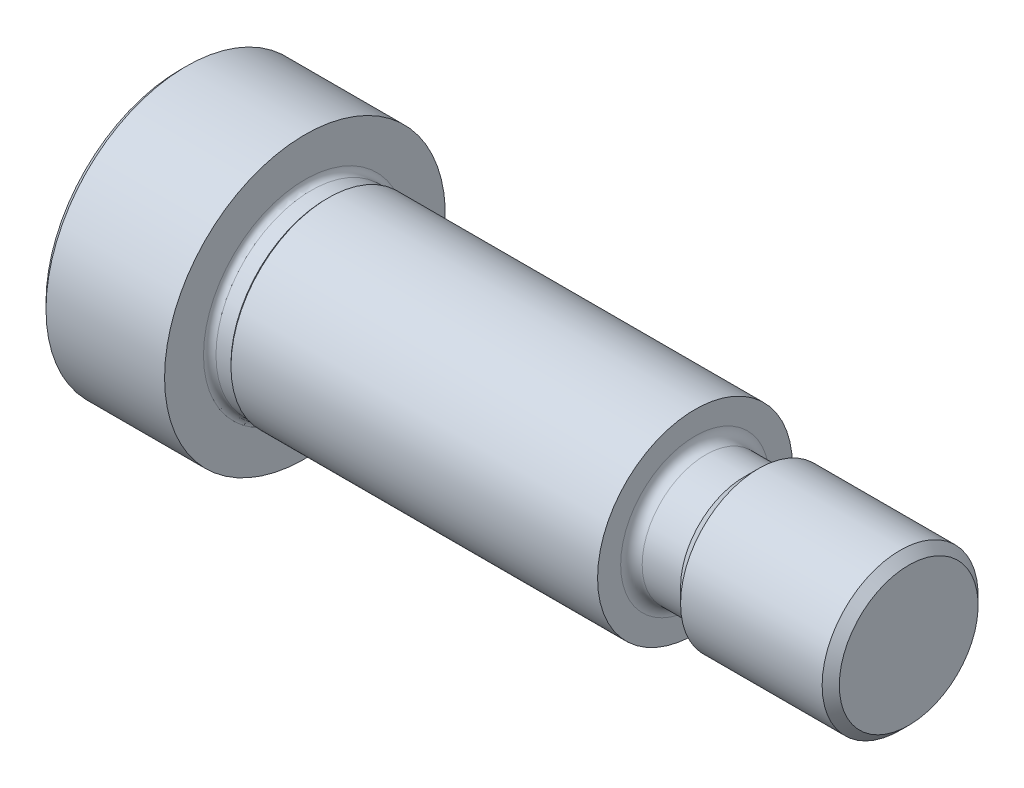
SolidWorks part; units mm, degrees
ref_plane "Plane1" through (0, 0, 0) normal (0, 0, 1) x (1, 0, 0)
ref_plane "Plane2" through (0, 0, 0) normal (0, 1, 0) x (1, 0, 0)
ref_plane "Plane3" through (0, 0, 0) normal (1, 0, 0) x (0, 0, -1)
sketch "BodySke" plane through (0, 0, 0) normal (0, 0, 1) x (1, 0, 0)
  line L0 (0, 0) -> (0, 18)
  line L2 (0, 18) -> (16, 18)
  line L3 (16, 18) -> (16, 13.01)
  line L4 (16.8, 12.21) -> (18.72, 12.21)
  line L5 (18.72, 12.21) -> (19, 12.49)
  line L6 (19, 12.49) -> (66, 12.49)
  line L7 (66, 12.49) -> (66, 9.53)
  line L8 (67.38, 8.15) -> (72.3, 8.15)
  line L9 (72.3, 8.15) -> (74.15, 10)
  line L10 (74.15, 10) -> (92.2985, 10)
  line L11 (92.2985, 10) -> (93.4, 8.8985)
  line L12 (93.4, 8.8985) -> (93.4, 0)
  line L13 (93.4, 0) -> (0, 0)
  line L14 (-6.35, 0) -> (107.95, 0) construction
  line L15 (92.2985, -10) -> (93.4, -8.8985) construction
  line L16 (66, -8.15) -> (72.3, -8.15) construction
  line L17 (19, -12.49) -> (66, -12.49) construction
  line L18 (16, -12.21) -> (18.72, -12.21) construction
  line L20 (74.8, 13.0014) -> (74.8, -4.3514) construction
  line L21 (70.54, 12.6746) -> (70.54, -3.175) construction
  arc A0 (66, 9.53) -> (67.38, 8.15) centre (67.38, 9.53) ccw
  arc A1 (16.8, 12.21) -> (16, 13.01) centre (16.8, 13.01) cw
  point P29 (66, 8.15)
  point P32 (16, 12.21)
  dimension "Thread_neck_fillet_rad" = 1.38
  dimension "Head_fillet_radius" = 0.8
  dimension "Head_dia" = 36
  dimension "Head_ht" = 16
  dimension "Shoulder_neck_dia" = 24.42
  dimension "Diameter" = 24.98
  dimension "Thread_dia" = 20
  dimension "Minor_dia" = 17.797
  dimension "Thread_ch_ang" = 45
  dimension "Thread_neck_dia" = 16.3
  dimension "D11" = 45
  dimension "Thread_length" = 27.4
  dimension "D13" = 45
  dimension "Length" = 50
  dimension "Thread_neck_width" = 6.3
  dimension "Shoulder_neck_width" = 3
  dimension "Advance" = 2.5
  dimension "Thread_nom" = 22.86
  dimension "Thread_lim" = 18.6
revolve "BaseBody" add sketch "BodySke" angle 360 about L14
chamfer "Chamfer1" distance 0.8 1 edges at (0, 0, 18)
sketch "Sketch2" plane through (0, 0, 0) normal (0, 0, 1) x (1, 0, 0)
  line L0 (0, 6) -> (10, 6)
  line L1 (10, 6) -> (13.4641, 0)
  line L3 (13.4641, 0) -> (0, 0)
  line L4 (0, 0) -> (0, 6)
  line L5 (0, -6) -> (10, -6) construction
  line L6 (0, 0) -> (47.625, 0) construction
  dimension "D2" = 60
  dimension "PreBroach_depth" = 10
  dimension "PreBroach_dia" = 12
revolve "PreBroach" cut sketch "Sketch2" angle 360 about L6
sketch "Sketch3" plane through (0, 0, 0) normal (-1, 0, 0) x (0, 0, 1)
  line L0 (-6, -3.4641) -> (-6, 3.4641)
  line L1 (-6, 3.4641) -> (0, 6.9282)
  line L2 (0, 6.9282) -> (6, 3.4641)
  line L3 (6, 3.4641) -> (6, -3.4641)
  line L4 (6, -3.4641) -> (0, -6.9282)
  line L5 (0, -6.9282) -> (-6, -3.4641)
  dimension "D1" = 6
  dimension "Hex_size" = 12
  dimension "D2" = 6
  dimension "D3" = 120
  dimension "D4" = 12
extrude "Hex" cut sketch "Sketch3" against normal blind 10
sketch "ThdSchSke" plane through (0, 0, 0) normal (0, 0, 1) x (1, 0, 0)
  line L0 (74.8, -8.8985) -> (72.2852, -12.49)
  line L1 (74.8, -8.8985) -> (77.3148, -12.49)
  line L2 (77.3148, -12.49) -> (77.3148, -15.6125)
  line L3 (-3.175, 0) -> (5.1513, 0) construction
  line L5 (77.3148, -15.6125) -> (72.2852, -15.6125)
  line L6 (72.2852, -15.6125) -> (72.2852, -12.49)
  dimension "Thread_minor" = 17.797
  dimension "Diameter" = 24.98
  dimension "Start" = 74.8
  dimension "SideAngle" = 55
  dimension "VeeAngle" = 70
  dimension "Overcut" = 31.225
revolve "ThreadSchematic" [suppressed] cut sketch "ThdSchSke" angle 360 about L3
pattern_linear "ThdSchPat" [suppressed]
equation "\"Thread_minor@ThreadCosmetic\" = \"Minor_dia@BodySke\""
equation "\"D1@Sketch3\" = \"Hex_size@Sketch3\" / 2"
equation "\"D2@Sketch3\" = \"D1@Sketch3\""
equation "\"D4@Sketch3\" = \"Hex_size@Sketch3\""
equation "\"Width@Chamfer1\" = \"Head_fillet_radius@BodySke\""
equation "\"Thread_length@ThreadCosmetic\" = ((sgn( (\"Thread_length@BodySke\" - \"Advance@BodySke\" - \"Thread_neck_width@BodySke\" ) - \"Thread_nom@BodySke\" )-1)*( (\"Thread_length@BodySke\" - \"Advance@BodySke\" - \"Threa"
equation "\"Thread_minor@ThdSchSke\" = \"Minor_dia@BodySke\""
equation "\"Diameter@ThdSchSke\" = \"Diameter@BodySke\""
equation "\"Overcut@ThdSchSke\" = \"Diameter@BodySke\" * 1.25"
equation "\"Start@ThdSchSke\" = \"Head_ht@BodySke\" + \"Length@BodySke\" + \"Thread_length@BodySke\" -  \"Thread_length@ThreadCosmetic\"  '---Non-countersunk---"
equation "\"Num_threads@ThdSchPat\" = int( \"Thread_length@ThreadCosmetic\" / \"Advance@BodySke\" + 0.999 ) + 1"
equation "\"Advance@ThdSchPat\" = \"Thread_length@ThreadCosmetic\" /  (\"Num_threads@ThdSchPat\" - 1) 'relax it"
equation "\"Num_threads@ThdSchPat\" = \"Num_threads@ThdSchPat\" - sgn( \"Num_threads@ThdSchPat\" - 1) '---chamfered tips only---"
